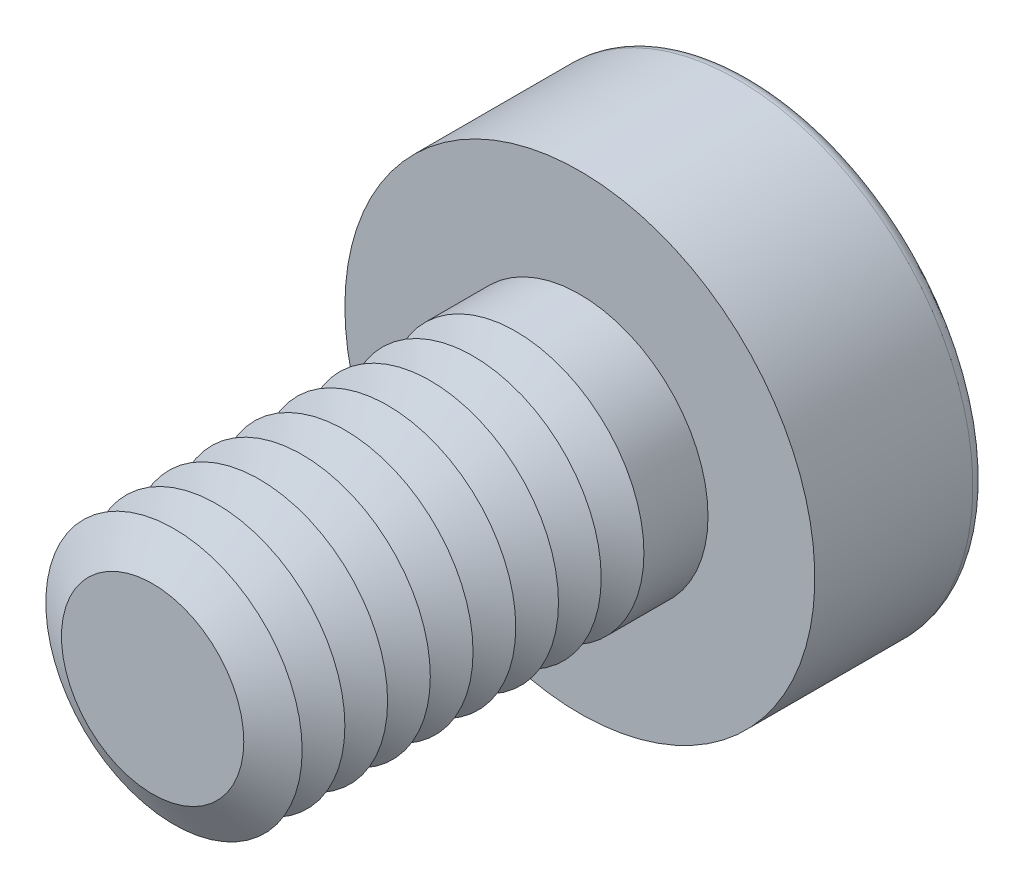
SolidWorks part; units mm, degrees
ref_plane "Front Plane" through (0, 0, 0) normal (0, 0, 1) x (1, 0, 0)
ref_plane "Top Plane" through (0, 0, 0) normal (0, 1, 0) x (1, 0, 0)
ref_plane "Right Plane" through (0, 0, 0) normal (1, 0, 0) x (0, 0, -1)
sketch "Sketch1" plane through (0, 0, 0) normal (0, 0, 1) x (1, 0, 0)
  circle A0 centre (0, 0) radius 1.5
  dimension "D1" = 3
extrude "Boss-Extrude1" add sketch "Sketch1" along normal blind 5
sketch "Sketch2" plane through (0, 0, 0) normal (0, 0, -1) x (-1, 0, 0)
  circle A0 centre (0, 0) radius 2.75
  dimension "D1" = 5.5
extrude "Boss-Extrude2" add sketch "Sketch2" along normal blind 2
sketch "Sketch3" plane through (0, 0, -2) normal (0, 0, -1) x (-1, 0, 0)
  line L1 (-0.5774, 1) -> (-1.1547, 0)
  line L2 (-1.1547, 0) -> (-0.5774, -1)
  line L3 (-0.5774, -1) -> (0.5774, -1)
  line L4 (0.5774, -1) -> (1.1547, 0)
  line L5 (1.1547, 0) -> (0.5774, 1)
  line L6 (0.5774, 1) -> (-0.5774, 1)
  circle A0 centre (0, 0) radius 1 construction
  dimension "D1" = 2
extrude "Cut-Extrude1" cut sketch "Sketch3" against normal blind 1.5
fillet "Fillet1" radius 0.15 1 edges at (-2.75, 0, -2)
sketch "Sketch4" plane through (0, 0, -0.5) normal (0, 0, -1) x (-1, 0, 0)
  line L0 (0.5774, -1) -> (1.1547, 0) construction
  circle A0 centre (0, 0) radius 1
extrude "Cut-Extrude2" cut sketch "Sketch4" against normal through all draft 60
sketch "Sketch5" plane through (0, 0, -2) normal (0, 0, -1) x (-1, 0, 0)
  circle A0 centre (0, 0) radius 1.1547
extrude "Cut-Extrude3" cut sketch "Sketch5" against normal through all draft 75
sketch "Sketch7" plane through (0, 0, 0) normal (1, 0, 0) x (0, 0, -1)
  line L25 (-5, 1.067) -> (-4.75, 1.5)
  line L26 (-5, 1.5) -> (-5, -1.5) construction
  line L27 (-4.75, 1.5) -> (-5.25, 1.5)
  line L28 (-5.25, 1.5) -> (-5, 1.067)
  line L29 (0, 1.5) -> (-5, 1.5) construction
  dimension "D1" = 0.5
revolve "Cut-Revolve1" cut sketch "Sketch7" angle 360 about axis through (0, 0, 5) along (0, 0, -1)
pattern_linear "LPattern1" count 9 spacing 0.5 along (0, 0, -1) of "Cut-Revolve1"
